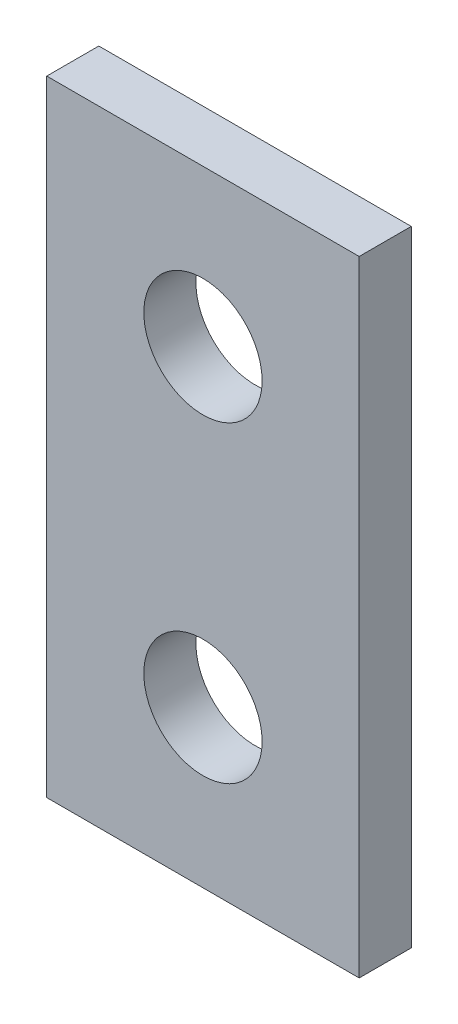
SolidWorks part; units mm, degrees
ref_plane "Front Plane" through (0, 0, 0) normal (0, 0, 1) x (1, 0, 0)
ref_plane "Top Plane" through (0, 0, 0) normal (0, 1, 0) x (1, 0, 0)
ref_plane "Right Plane" through (0, 0, 0) normal (1, 0, 0) x (0, 0, -1)
sketch "Sketch1" plane through (0, 0, 0) normal (0, 0, 1) x (1, 0, 0)
  line L1 (-4.7625, -9.525) -> (4.7625, -9.525)
  line L2 (-4.7625, -9.525) -> (-4.7625, 9.525)
  line L3 (-4.7625, 9.525) -> (4.7625, 9.525)
  line L4 (4.7625, -9.525) -> (4.7625, 9.525)
  line L5 (-4.7625, -9.525) -> (4.7625, 9.525) construction
  line L6 (-4.7625, 9.525) -> (4.7625, -9.525) construction
  point P0 (0, 0)
  dimension "D1" = 19.05
  dimension "D2" = 9.525
extrude "Boss-Extrude1" add sketch "Sketch1" against normal blind 1.5875
sketch "Sketch2" plane through (0, 0, 0) normal (0, 0, 1) x (1, 0, 0)
  line L1 (-1.2973, -4.7625) -> (1.2973, -4.7625) construction
  line L2 (-1.2973, -4.7625) -> (-1.2973, 4.7625) construction
  line L3 (-1.2973, 4.7625) -> (1.2973, 4.7625) construction
  line L4 (1.2973, -4.7625) -> (1.2973, 4.7625) construction
  line L5 (-1.2973, -4.7625) -> (1.2973, 4.7625) construction
  line L6 (-1.2973, 4.7625) -> (1.2973, -4.7625) construction
  circle A0 centre (0, 4.7625) radius 1.8034
  circle A1 centre (0, -4.7625) radius 1.8034
  point P0 (0, 0)
  dimension "D3" = 3.6068
  dimension "D1" = 9.525
  dimension "D2" = 2.5947
extrude "Cut-Extrude1" cut sketch "Sketch2" against normal through all
